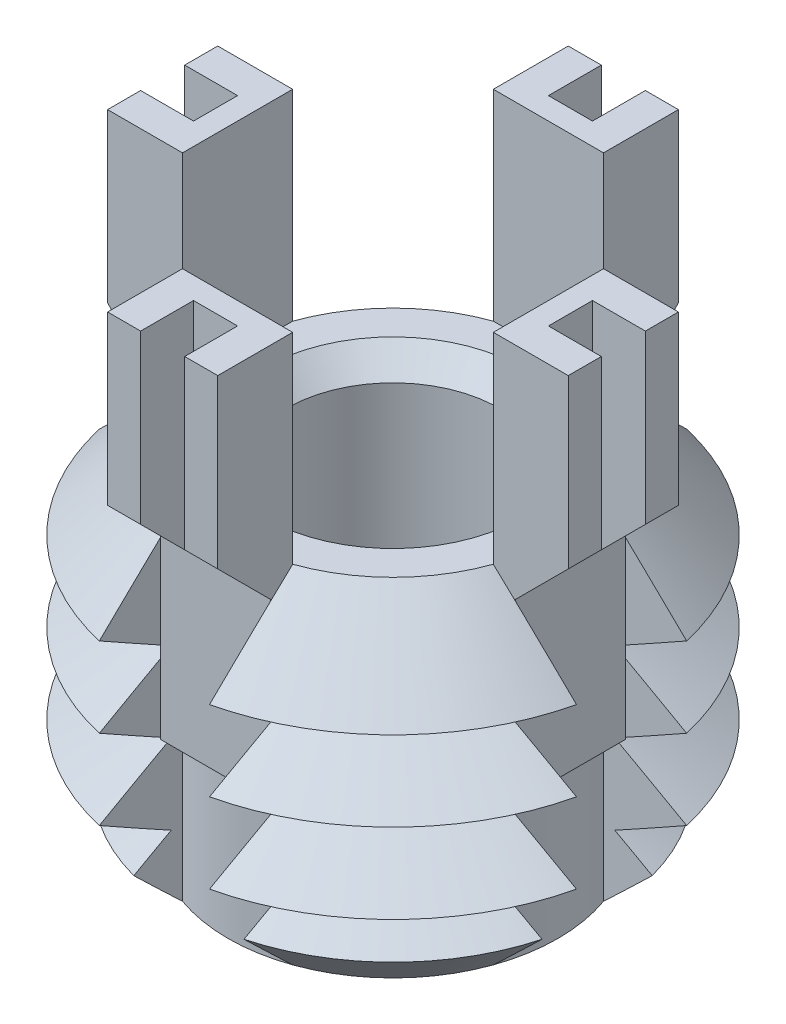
SolidWorks part; units mm, degrees
ref_plane "Front Plane" through (0, 0, 0) normal (0, 0, 1) x (1, 0, 0)
ref_plane "Top Plane" through (0, 0, 0) normal (0, 1, 0) x (1, 0, 0)
ref_plane "Right Plane" through (0, 0, 0) normal (1, 0, 0) x (0, 0, -1)
sketch "Sketch1" plane through (0, 0, 0) normal (0, 1, 0) x (1, 0, 0)
  circle A0 centre (0, 0) radius 5.556
  dimension "D1" = 11.112
extrude "Boss-Extrude1" add sketch "Sketch1" against normal blind 7.874
chamfer "Chamfer1" distance 1.814 angle 45 2 edges at (0, -7.874, 5.556) (0, 0, 5.556)
sketch "Sketch2" plane through (0, 0, 0) normal (1, 0, 0) x (0, 0, -1)
  line L0 (0, 0.8859) -> (0, -9.2617) construction
sketch "Sketch3" plane through (0, 0, 0) normal (1, 0, 0) x (0, 0, -1)
  line L0 (-5.556, -1.814) -> (-3.985, -2.721)
  line L1 (-3.985, -2.721) -> (-5.556, -3.628)
  line L2 (-5.556, -1.814) -> (-5.556, -6.06) construction
  line L3 (-5.556, -3.628) -> (-5.556, -1.814)
  dimension "D1" = 1.814
revolve "Cut-Revolve1" cut sketch "Sketch3" angle 360 about L0
pattern_linear "LPattern1" count 3 spacing 1.814 along (0, -1, 0) of "Cut-Revolve1"
sketch "Sketch4" plane through (0, 0, 0) normal (0, 1, 0) x (1, 0, 0)
  line L0 (-3.527, 1.25) -> (-5.4136, 1.25)
  line L2 (-5.4136, -1.25) -> (-3.527, -1.25)
  arc A0 (-3.527, 1.25) -> (-3.527, -1.25) centre (0, 0) ccw
  arc A1 (-5.4136, 1.25) -> (-5.4136, -1.25) centre (0, 0) ccw
  circle A2 centre (0, 0) radius 5.556 construction
  circle A3 centre (0, 0) radius 3.742 construction
  point P1 (-3.742, 0)
  point P3 (-5.556, 0)
  point P13 (0, 0)
  dimension "D1" = 2.5
extrude "Cut-Extrude1" cut sketch "Sketch4" against normal up to surface (7.874 mm away)
pattern_circular "CirPattern1" count 4 over 360 about axis through (0, 0, 0) along (0, 1, 0) of "Cut-Extrude1"
sketch "Sketch5" plane through (0, 0, 0) normal (1, 0, 0) x (0, 0, -1)
  line L0 (-3.527, 4.558) -> (-3.527, -4.442)
  line L1 (-3.527, -4.442) -> (-4.027, -4.442)
  line L2 (-4.027, -4.442) -> (-4.027, -0.442)
  line L3 (-4.027, -0.442) -> (-5.227, 0.758)
  line L4 (-5.227, 0.758) -> (-5.227, 4.558)
  line L5 (-5.227, 4.558) -> (-3.527, 4.558)
  line L6 (-5.4136, -5.442) -> (-1.25, -5.442) construction
  point P9 (-1.25, 0)
  point P10 (-4.027, -0.442)
  dimension "D1" = 1
  dimension "D2" = 9
  dimension "D3" = 5
  dimension "D4" = 1.7
  dimension "D5" = 0.5
  dimension "D6" = 45
extrude "Boss-Extrude3" add sketch "Sketch5" along normal mid plane 2.5
pattern_circular "CirPattern2" count 4 over 360 about axis through (0, 0, 0) along (0, 1, 0) of "Boss-Extrude3"
sketch "Sketch6" plane through (0, 4.558, 0) normal (0, 1, 0) x (1, 0, 0)
  line L0 (-5.227, -1.25) -> (-5.227, 1.25) construction
  line L1 (-5.227, -0.5) -> (-4.027, -0.5)
  line L2 (-5.227, -0.5) -> (-5.227, 0.5)
  line L3 (-5.227, 0.5) -> (-4.027, 0.5)
  line L4 (-4.027, -0.5) -> (-4.027, 0.5)
  line L5 (-5.227, -0.5) -> (-4.027, 0.5) construction
  line L6 (-5.227, 0.5) -> (-4.027, -0.5) construction
  line L7 (5.227, 1.25) -> (5.227, -1.25) construction
  line L8 (-0.5, 4.027) -> (0.5, 4.027)
  line L9 (-0.5, 4.027) -> (-0.5, 5.227)
  line L10 (-0.5, 5.227) -> (0.5, 5.227)
  line L11 (0.5, 4.027) -> (0.5, 5.227)
  line L12 (-0.5, 4.027) -> (0.5, 5.227) construction
  line L13 (-0.5, 5.227) -> (0.5, 4.027) construction
  line L14 (4.027, -0.5) -> (5.227, -0.5)
  line L15 (4.027, -0.5) -> (4.027, 0.5)
  line L16 (4.027, 0.5) -> (5.227, 0.5)
  line L17 (5.227, -0.5) -> (5.227, 0.5)
  line L18 (4.027, -0.5) -> (5.227, 0.5) construction
  line L19 (4.027, 0.5) -> (5.227, -0.5) construction
  line L20 (-0.5, -5.227) -> (0.5, -5.227)
  line L21 (-0.5, -5.227) -> (-0.5, -4.027)
  line L22 (-0.5, -4.027) -> (0.5, -4.027)
  line L23 (0.5, -5.227) -> (0.5, -4.027)
  line L24 (-0.5, -5.227) -> (0.5, -4.027) construction
  line L25 (-0.5, -4.027) -> (0.5, -5.227) construction
  line L26 (-1.25, 5.227) -> (1.25, 5.227) construction
  line L27 (1.25, -5.227) -> (-1.25, -5.227) construction
  point P0 (-4.627, 0)
  point P7 (-5.227, 0)
  point P8 (-5.227, 0)
  point P9 (0, 4.627)
  point P14 (4.627, 0)
  point P19 (0, -4.627)
  point P24 (0, 5.227)
  point P25 (5.227, 0)
  point P26 (5.227, 0)
  point P27 (0, 5.227)
  point P30 (0, -5.227)
  point P33 (0, -5.227)
  dimension "D1" = 1
  dimension "D2" = 1.2
extrude "Cut-Extrude3" cut sketch "Sketch6" against normal through all both and the other way through all
sketch "Sketch7" plane through (0, 0, 0) normal (0, 1, 0) x (1, 0, 0)
  circle A0 centre (0, 0) radius 2.413
  dimension "D1" = 4.826
extrude "Cut-Extrude4" cut sketch "Sketch7" against normal up to surface (7.874 mm away)
chamfer "Chamfer2" distance 0.529 angle 45 2 edges at (0, 0, 2.413) (0, -7.874, 2.413)
